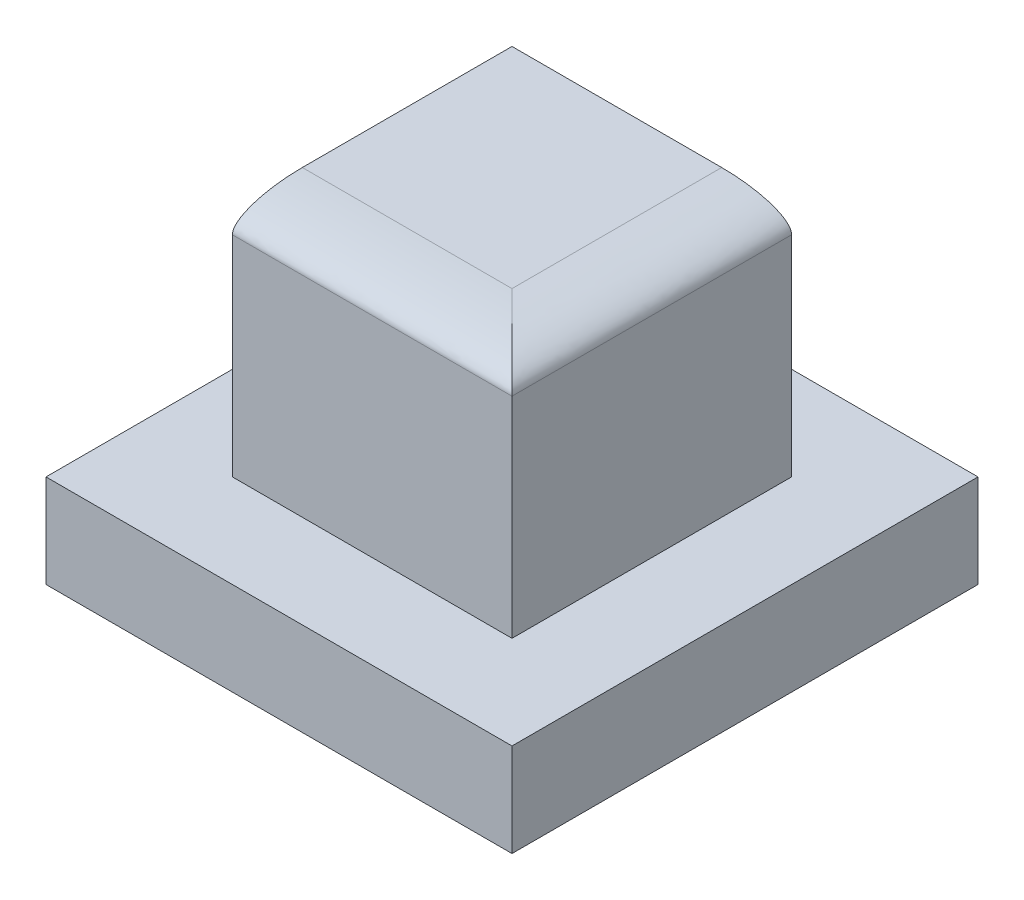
SolidWorks part; units mm, degrees
ref_plane "Front" through (0, 0, 0) normal (0, 0, 1) x (1, 0, 0)
ref_plane "Top" through (0, 0, 0) normal (0, 1, 0) x (1, 0, 0)
ref_plane "Right" through (0, 0, 0) normal (1, 0, 0) x (0, 0, -1)
sketch "Sketch1" plane through (0, 0, 0) normal (0, 0, 1) x (1, 0, 0)
  line L1 (-50, 20) -> (50, 20)
  line L2 (-50, 20) -> (-50, 0)
  line L3 (-50, 0) -> (50, 0)
  line L4 (50, 20) -> (50, 0)
  dimension "D1" = 20
  dimension "D2" = 100
extrude "Extrude1" add sketch "Sketch1" along normal mid plane 100
sketch "Sketch2" plane through (0, 20, 0) normal (0, 1, 0) x (-1, 0, 0)
  line L0 (30, -30) -> (-30, 30) construction
  line L1 (-30, 30) -> (30, 30)
  line L2 (-30, 30) -> (-30, -30)
  line L3 (-30, -30) -> (30, -30)
  line L4 (30, 30) -> (30, -30)
  dimension "D1" = 60
  dimension "D2" = 60
extrude "Extrude2" add sketch "Sketch2" along normal blind 50
fillet "Fillet1" radius 5 2 edges at (30, 70, 0) (0, 70, 30)
